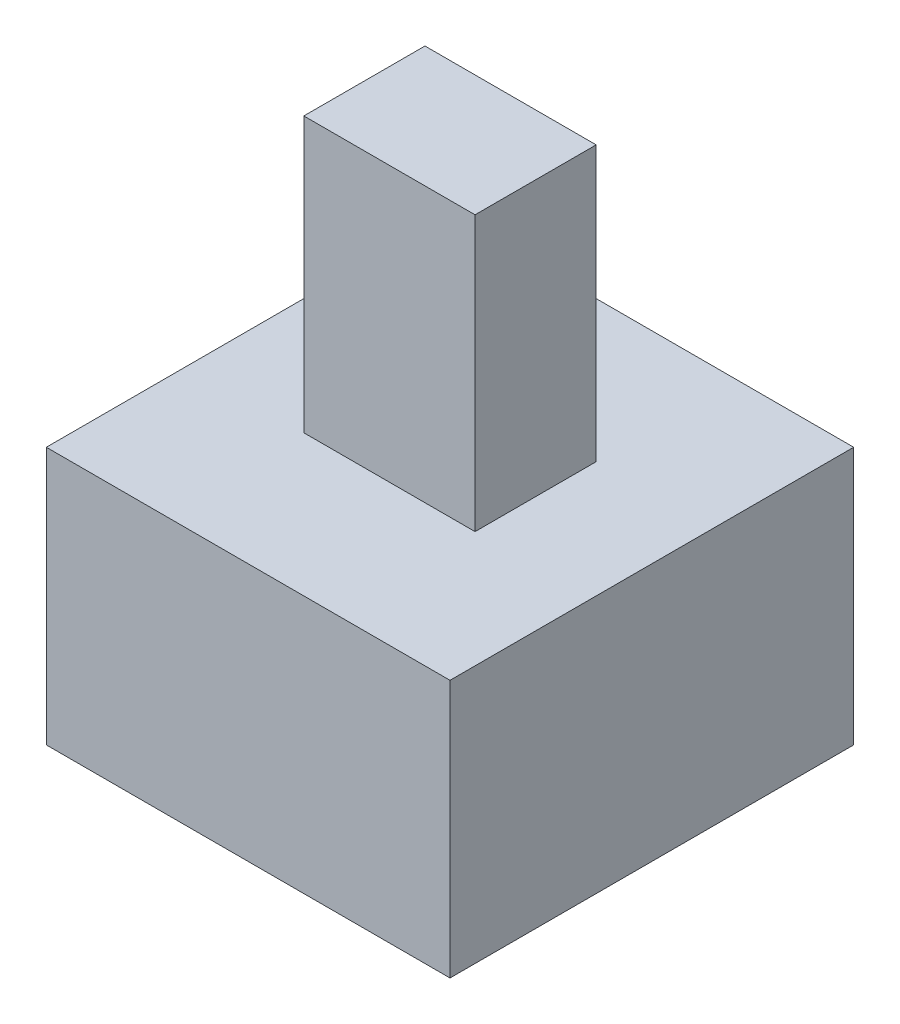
SolidWorks part; units mm, degrees
ref_plane "Front Plane" through (0, 0, 0) normal (0, 0, 1) x (1, 0, 0)
ref_plane "Top Plane" through (0, 0, 0) normal (0, 1, 0) x (1, 0, 0)
ref_plane "Right Plane" through (0, 0, 0) normal (1, 0, 0) x (0, 0, -1)
sketch "Sketch1" plane through (0, 0, 0) normal (0, 1, 0) x (1, 0, 0)
  line L0 (48.7636, -48.7636) -> (-48.7636, 48.7636) construction
  line L1 (-48.7636, 48.7636) -> (48.7636, 48.7636)
  line L2 (-48.7636, 48.7636) -> (-48.7636, -48.7636)
  line L3 (-48.7636, -48.7636) -> (48.7636, -48.7636)
  line L4 (48.7636, 48.7636) -> (48.7636, -48.7636)
extrude "Extrude1" add sketch "Sketch1" along normal blind 62.2905
sketch "Sketch2" plane through (0, 62.2905, 0) normal (0, 1, 0) x (-1, 0, 0)
  line L0 (-20.6823, 14.6327) -> (20.6823, -14.6327) construction
  line L1 (-20.6823, 14.6327) -> (20.6823, 14.6327)
  line L2 (-20.6823, 14.6327) -> (-20.6823, -14.6327)
  line L3 (-20.6823, -14.6327) -> (20.6823, -14.6327)
  line L4 (20.6823, 14.6327) -> (20.6823, -14.6327)
extrude "Extrude2" add sketch "Sketch2" along normal blind 66.2965
